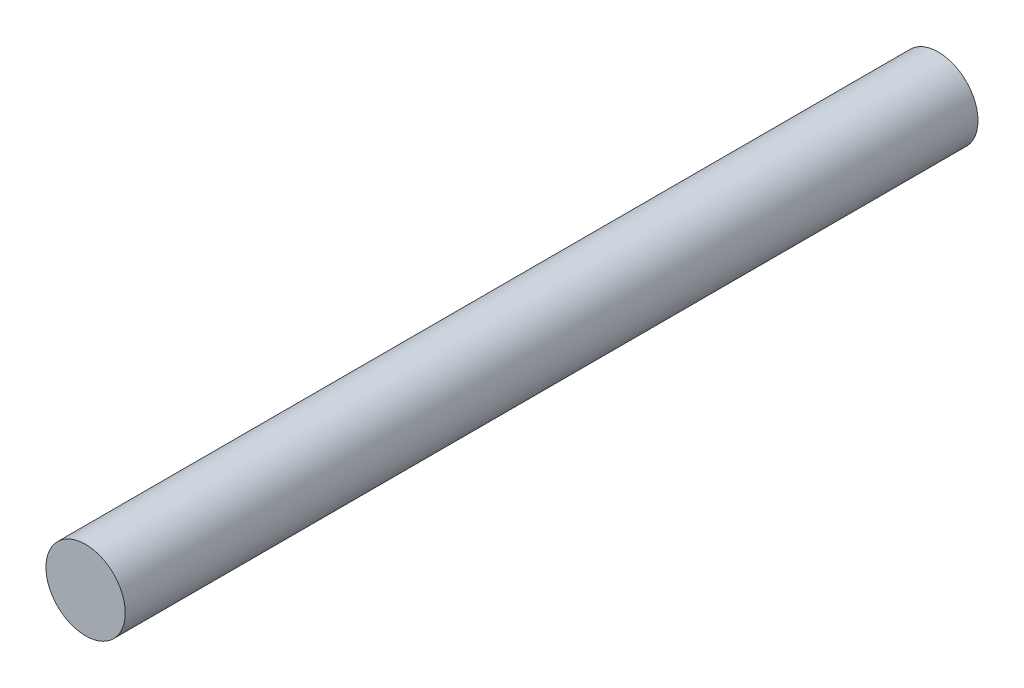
SolidWorks part; units mm, degrees
ref_plane "前视基准面" through (0, 0, 0) normal (0, 0, 1) x (1, 0, 0)
ref_plane "上视基准面" through (0, 0, 0) normal (0, 1, 0) x (1, 0, 0)
ref_plane "右视基准面" through (0, 0, 0) normal (1, 0, 0) x (0, 0, -1)
sketch "草图1" plane through (0, 0, 0) normal (0, 0, 1) x (1, 0, 0)
  circle A0 centre (0, 0) radius 2
  dimension "D1" = 4
extrude "凸台-拉伸1" add sketch "草图1" along normal mid plane 43
sketch "草图2" plane through (0, 0, 0) normal (1, 0, 0) x (0, 0, -1)
  line L0 (-19.5, 0) -> (-15.5, 0) construction
  line L1 (-19.5, 0.8) -> (-15.5, 0.8)
  line L2 (-19.5, -0.8) -> (-15.5, -0.8)
  line L3 (-21.5, 2) -> (-21.5, -2) construction
  arc A0 (-19.5, 0.8) -> (-19.5, -0.8) centre (-19.5, 0) ccw
  arc A1 (-15.5, -0.8) -> (-15.5, 0.8) centre (-15.5, 0) ccw
  point P2 (-17.5, 0)
  dimension "D1" = 0.8
  dimension "D2" = 4
  dimension "D3" = 2
extrude "切除-拉伸1" cut sketch "草图2" against normal blind 20 from offset 1
mirror "镜向1" about plane through (0, 0, 0) normal (0, 0, 1) of "切除-拉伸1"
sketch "草图3" plane through (0, 0, 0) normal (1, 0, 0) x (0, 0, -1)
  line L0 (-21.5, 0) -> (21.5, 0) construction
  line L1 (-21.5, 2) -> (-21.5, -2) construction
  line L2 (21.5, -2) -> (21.5, 2) construction
